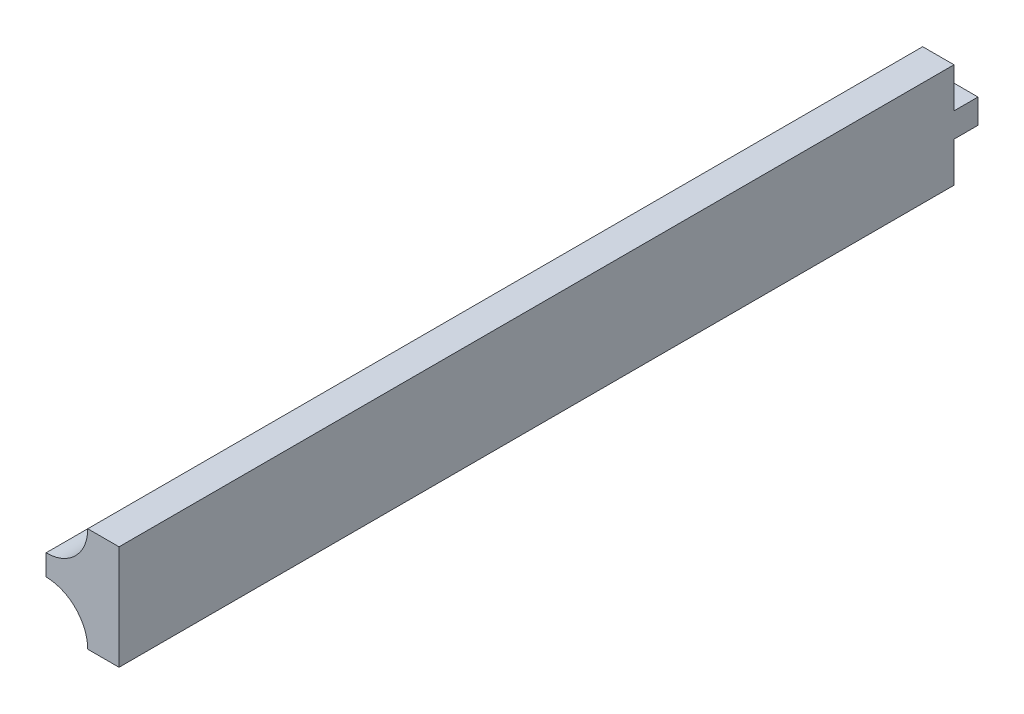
SolidWorks part; units mm, degrees
other "Markup1"
sketch "Sketch18" plane through (-127, 2.54, 10.16) normal (0, 1, 0) x (1, 0, 0)
sketch "Sketch20" plane through (-127, 2.54, 10.16) normal (0, 1, 0) x (1, 0, 0)
sketch "Sketch21" plane through (-127, 2.54, 10.16) normal (0, 1, 0) x (1, 0, 0)
sketch "Sketch22" plane through (-127, 2.54, 10.16) normal (0, 1, 0) x (1, 0, 0)
sketch "Sketch23" plane through (-127, 2.54, 10.16) normal (0, 1, 0) x (1, 0, 0)
sketch "Sketch24" plane through (-127, 2.54, 10.16) normal (0, 1, 0) x (1, 0, 0)
sketch "Sketch25" plane through (-127, 2.54, 10.16) normal (0, 1, 0) x (1, 0, 0)
sketch "Sketch27" plane through (-127, 2.54, 0) normal (0, 1, 0) x (1, 0, 0)
sketch "Sketch29" plane through (-127, 2.54, 0) normal (0, 1, 0) x (1, 0, 0)
sketch "Sketch30" plane through (-127, 2.54, 0) normal (0, 1, 0) x (1, 0, 0)
ref_plane "Front Plane" through (0, 0, 0) normal (0, 0, 1) x (1, 0, 0)
ref_plane "Top Plane" through (0, 0, 0) normal (0, 1, 0) x (1, 0, 0)
ref_plane "Right Plane" through (0, 0, 0) normal (1, 0, 0) x (0, 0, -1)
sketch "Sketch1" plane through (0, 0, 0) normal (0, 0, 1) x (1, 0, 0)
  line L6 (127, 2.54) -> (-127, 2.54)
  line L24 (127, 2.54) -> (127, -2.54)
  line L25 (127, -2.54) -> (-127, -2.54)
  line L26 (-127, 2.54) -> (-127, -2.54)
  line L27 (127, 2.54) -> (-127, -2.54) construction
  line L28 (127, -2.54) -> (-127, 2.54) construction
  point P0 (0, 0)
  point P1 (0, 0)
  dimension "D1" = 5.08
  dimension "D2" = 254
extrude "Boss-Extrude1" add sketch "Sketch1" along normal blind 203.2
sketch "Sketch2" plane through (0, 2.54, 0) normal (0, 1, 0) x (1, 0, 0)
  line L0 (127, -203.2) -> (-127, -203.2) construction
  line L1 (-127, 0) -> (-101.6, 0)
  line L2 (-127, 0) -> (-127, -203.2)
  line L3 (-127, -203.2) -> (-101.6, -203.2)
  line L4 (-101.6, 0) -> (-101.6, -203.2)
  line L6 (127, 0) -> (101.6, 0)
  line L7 (127, 0) -> (127, -203.2)
  line L8 (127, -203.2) -> (101.6, -203.2)
  line L9 (101.6, 0) -> (101.6, -203.2)
  dimension "D1" = 25.4
sketch "Sketch3" plane through (0, 2.54, 0) normal (0, 1, 0) x (1, 0, 0)
  line L1 (-127, -22.86) -> (-101.6, -22.86) construction
  line L2 (-127, 0) -> (-127, -203.2) construction
  line L3 (-101.6, 0) -> (-101.6, -203.2) construction
  line L4 (-114.3, -22.86) -> (-114.3, -180.34) construction
  line L5 (0, 0) -> (0, -203.2) construction
  line L6 (127, 0) -> (-127, 0) construction
  line L7 (127, -203.2) -> (-127, -203.2) construction
  line L8 (-127, 0) -> (-101.6, 0) construction
  line L9 (101.6, -21.6084) -> (127, -21.6084) construction
  line L10 (101.6, 0) -> (101.6, -203.2) construction
  line L11 (127, 0) -> (127, -203.2) construction
  circle A0 centre (-114.3, -22.86) radius 2.1
  circle A1 centre (-114.3, -180.34) radius 2.1
  circle A2 centre (114.3, -22.86) radius 2.1
  circle A3 centre (114.3, -180.34) radius 2.1
  point P14 (-114.3, -22.86)
  point P21 (-114.3, -101.6)
  point P22 (0, -101.6)
  point P26 (114.3, -21.6084)
  dimension "D1" = 4.2
  dimension "D2" = 22.86
extrude "Cut-Extrude1" [suppressed] cut sketch "Sketch3" against normal through all
sketch "Sketch5" plane through (0, 2.54, 0) normal (0, 1, 0) x (1, 0, 0)
  circle A2 centre (97.63, -133.2) radius 1.8288
  circle A3 centre (97.63, -133.2) radius 1.8288
  circle A4 centre (97.63, -145.9) radius 1.8288
  circle A5 centre (97.63, -145.9) radius 1.8288
  circle A6 centre (-19.21, -133.2) radius 1.8288
  circle A7 centre (-19.21, -133.2) radius 1.8288
  circle A8 centre (-19.21, -145.9) radius 1.8288
  circle A9 centre (-19.21, -145.9) radius 1.8288
  circle A13 centre (-97.696, -133.2) radius 1.8288
  circle A14 centre (-97.696, -145.9) radius 1.8288
  circle A15 centre (19.144, -133.2) radius 1.8288
  circle A16 centre (19.144, -145.9) radius 1.8288
  dimension "D5" = 78.486
  dimension "D6" = 78.486
  dimension "D1" = 0
  dimension "D2" = 0
  dimension "D3" = 0
  dimension "D4" = 0
extrude "Cut-Extrude2" cut sketch "Sketch5" against normal blind 152.4
sketch "Sketch7" [suppressed] plane through (0, -2.54, 0) normal (0, -1, 0) x (1, 0, 0)
  line L1 (-127, 203.2) -> (-101.6, 203.2)
  line L2 (-127, 203.2) -> (-127, 0)
  line L3 (-127, 0) -> (-101.6, 0)
  line L4 (-101.6, 203.2) -> (-101.6, 0)
  line L5 (127, 203.2) -> (101.6, 203.2)
  line L6 (127, 203.2) -> (127, 0)
  line L7 (127, 0) -> (101.6, 0)
  line L8 (101.6, 203.2) -> (101.6, 0)
  circle A0 centre (-114.3, 180.34) radius 6.35
  circle A1 centre (-114.3, 22.86) radius 6.35
  circle A2 centre (114.3, 22.86) radius 6.35
  circle A3 centre (114.3, 180.34) radius 6.35
  dimension "D1" = 12.7
extrude "Boss-Extrude2" [suppressed] add sketch "Sketch7" along normal blind 7.62
sketch "Sketch8" [suppressed] plane through (0, 2.54, 0) normal (0, 1, 0) x (1, 0, 0)
  circle A0 centre (-89.6874, -180.34) radius 3.175
  circle A1 centre (-89.6874, -154.94) radius 3.175
  point P3 (-114.3, -180.34)
  dimension "D1" = 6.35
  dimension "D2" = 24.6126
  dimension "D3" = 25.4
sketch "Sketch9" plane through (0, 2.54, 0) normal (0, 1, 0) x (1, 0, 0)
  line L0 (127, 0) -> (-127, 0) construction
  line L1 (-91.63, 0) -> (-83.63, 0)
  line L2 (-91.63, 0) -> (-91.63, -12.7)
  line L3 (-91.63, -12.7) -> (-83.63, -12.7)
  line L4 (-83.63, 0) -> (-83.63, -12.7)
  line L5 (-87.63, 0) -> (-87.63, -55.7623) construction
  line L6 (-127, -203.2) -> (-127, 0) construction
  line L7 (-61.405, -25.4) -> (-61.405, -12.7) construction
  circle A0 centre (-61.405, -12.7) radius 3.175
  circle A1 centre (-61.405, -25.4) radius 3.175
  dimension "D1" = 6.35
  dimension "D2" = 6.35
  dimension "D3" = 39.37
  dimension "D4" = 12.7
  dimension "D5" = 12.7
  dimension "D6" = 8
  dimension "D7" = 22.225
  dimension "D8" = 4
  dimension "D9" = 12.7
sketch "Sketch12" plane through (0, 2.54, 0) normal (0, 1, 0) x (1, 0, 0)
  line L0 (-91.7385, -29.21) -> (-40.9385, -29.21) construction
  line L1 (-127, -203.2) -> (-127, 0) construction
  line L2 (-66.3384, -41.91) -> (-66.3384, -16.51) construction
  line L4 (127, 0) -> (-127, 0) construction
  circle A0 centre (-91.7385, -29.21) radius 3.175
  circle A1 centre (-40.9385, -29.21) radius 3.175
  circle A2 centre (-66.3384, -16.51) radius 3.175
  circle A3 centre (-66.3384, -41.91) radius 3.175
  point P8 (-66.3385, -29.21)
  point P11 (-66.3385, -29.21)
  dimension "D1" = 6.35
  dimension "D2" = 50.8
  dimension "D3" = 29.21
  dimension "D4" = 25.4
  dimension "D5" = 60.6615
extrude "Cut-Extrude7" cut sketch "Sketch12" against normal through all
sketch "Sketch14" plane through (0, 2.54, 0) normal (0, 1, 0) x (1, 0, 0)
  line L0 (127, 0) -> (-127, 0) construction
  line L1 (-127, -203.2) -> (-127, 0) construction
  circle A0 centre (-32.8328, -16.51) radius 3.175
  circle A1 centre (-32.8328, -41.91) radius 3.175
  dimension "D1" = 6.35
  dimension "D4" = 94.1672
  dimension "D2" = 25.4
  dimension "D3" = 16.51
extrude "Cut-Extrude8" cut sketch "Sketch14" against normal up to next
mirror "Mirror1" about plane through (0, 0, 0) normal (1, 0, 0) of "Cut-Extrude8", "Cut-Extrude7"
sketch "Sketch15" plane through (0, 2.54, 0) normal (0, 1, 0) x (1, 0, 0)
  line L0 (127, -203.2) -> (127, 0) construction
  line L1 (-127, 0) -> (127, 0)
  line L2 (-127, 0) -> (-127, -10.16)
  line L3 (-127, -10.16) -> (127, -10.16)
  line L4 (127, 0) -> (127, -10.16)
  dimension "D1" = 10.16
extrude "Cut-Extrude9" [suppressed] cut sketch "Sketch15" against normal up to next
sketch "Sketch16" plane through (0, 2.54, 0) normal (0, 1, 0) x (1, 0, 0)
  line L0 (127, -203.2) -> (127, 0) construction
  line L1 (127, -203.2) -> (-127, -203.2) construction
  circle A0 centre (84.0486, -196.85) radius 3.175
  circle A1 centre (84.0486, -171.45) radius 3.175
  dimension "D2" = 6.35
  dimension "D1" = 42.9514
  dimension "D3" = 25.4
  dimension "D4" = 6.35
extrude "Cut-Extrude10" cut sketch "Sketch16" against normal through all
mirror "Mirror2" about plane through (0, 0, 0) normal (1, 0, 0) of "Cut-Extrude10"
sketch "Sketch17" plane through (0, 2.54, 0) normal (0, 1, 0) x (1, 0, 0)
  line L0 (-97.696, -133.2) -> (-19.21, -133.2) construction
  line L1 (-58.453, -133.2) -> (-58.453, -151.0054) construction
  point P6 (-19.21, -133.2)
ref_plane "Plane1" through (-58.453, 0, 0) normal (-1, 0, 0) x (0, 0, 1)
sketch "Sketch19" plane through (0, 2.54, 0) normal (0, 1, 0) x (1, 0, 0)
  line L0 (-84.0486, -171.45) -> (-28.3574, -171.45) construction
  line L1 (-84.0486, -196.85) -> (-28.3574, -196.85) construction
  line L2 (-84.0486, -182.2625) -> (-58.453, -182.2625) construction
  line L3 (-58.453, 111.76) -> (-58.453, -111.76) construction
  line L4 (-58.453, -182.2625) -> (-32.8574, -182.2625) construction
  circle A0 centre (-28.3574, -171.45) radius 3.175
  circle A1 centre (-28.3574, -196.85) radius 3.175
  circle A2 centre (-84.0486, -171.45) radius 3.175 construction
  dimension "D1" = 4.5
extrude "Cut-Extrude11" cut sketch "Sketch19" against normal up to next
mirror "Mirror3" about plane through (0, 0, 0) normal (1, 0, 0) of "Cut-Extrude11"
sketch "Sketch26" plane through (0, 2.54, 0) normal (0, 1, 0) x (1, 0, 0)
  line L1 (-98.2063, -23.913) -> (-35.7027, -23.913)
  line L2 (-98.2063, -23.913) -> (-98.2063, -34.7388)
  line L3 (-98.2063, -34.7388) -> (-35.7027, -34.7388)
  line L4 (-35.7027, -23.913) -> (-35.7027, -34.7388)
  line L5 (31.7031, -23.913) -> (98.7003, -23.913)
  line L6 (31.7031, -23.913) -> (31.7031, -34.7388)
  line L7 (31.7031, -34.7388) -> (98.7003, -34.7388)
  line L8 (98.7003, -23.913) -> (98.7003, -34.7388)
extrude "Boss-Extrude3" add sketch "Sketch26" against normal up to surface (5.08 mm away)
sketch "Sketch28" plane through (0, 2.54, 0) normal (0, 1, 0) x (1, 0, 0)
  line L0 (127, -203.2) -> (-127, -203.2) construction
  line L1 (-68.903, -203.2) -> (-43.503, -203.2)
  line L2 (-68.903, -203.2) -> (-68.903, -190.5)
  line L3 (-68.903, -190.5) -> (-43.503, -190.5)
  line L4 (-43.503, -203.2) -> (-43.503, -190.5)
  line L5 (-84.0486, -171.45) -> (-28.3574, -171.45) construction
  line L6 (43.503, -203.2) -> (68.903, -203.2)
  line L7 (43.503, -203.2) -> (43.503, -190.5)
  line L8 (43.503, -190.5) -> (68.903, -190.5)
  line L9 (68.903, -203.2) -> (68.903, -190.5)
  line L10 (28.3574, -171.45) -> (84.0486, -171.45) construction
  point P18 (-56.203, -190.5)
  point P19 (-56.203, -171.45)
  point P20 (56.203, -190.5)
  point P21 (56.203, -171.45)
  dimension "D1" = 25.4
  dimension "D2" = 12.7
extrude "Cut-Extrude12" cut sketch "Sketch28" against normal up to next
sketch "Sketch31" plane through (0, 2.54, 0) normal (0, 1, 0) x (1, 0, 0)
  line L0 (-127, 0) -> (127, 0) construction
  line L2 (-127, -203.2) -> (0, -203.2)
  line L3 (-127, -203.2) -> (-127, 0)
  line L4 (-127, 0) -> (0, 0)
  line L5 (0, -203.2) -> (0, 0)
extrude "Cut-Extrude14" cut sketch "Sketch31" against normal up to next
sketch "Sketch34" plane through (0, 2.54, 0) normal (0, 1, 0) x (1, 0, 0)
  line L1 (127, 0) -> (114.3, 0)
  line L2 (127, 0) -> (127, 152.4)
  line L3 (127, 152.4) -> (114.3, 152.4)
  line L4 (114.3, 0) -> (114.3, 152.4)
  dimension "D1" = 12.7
  dimension "D2" = 152.4
extrude "Boss-Extrude5" add sketch "Sketch34" against normal up to surface (5.08 mm away)
sketch "Sketch35" plane through (0, -2.54, 0) normal (0, -1, 0) x (1, 0, 0)
  line L0 (93.7489, 203.2) -> (93.7489, -151.0184)
  line L1 (68.903, 203.2) -> (127, 203.2) construction
  line L2 (127, 203.2) -> (127, -152.4) construction
  line L3 (127, -38.1) -> (93.7489, -38.1)
  line L4 (0, 0) -> (114.3, 0) construction
  point P10 (0, 0)
  dimension "D1" = 33.2511
  dimension "D2" = 38.1
sketch "Sketch36" plane through (114.3, 0, 0) normal (-1, 0, 0) x (0, 0, 1)
  line L0 (-38.1, -2.54) -> (-38.1, 2.54) construction
  line L1 (203.2, -2.54) -> (-151.0184, -2.54) construction
  line L2 (-152.4, 2.54) -> (0, 2.54) construction
  line L4 (-12.7, -25.4) -> (-63.5, -25.4)
  line L5 (-12.7, -25.4) -> (-12.7, 25.4)
  line L6 (-12.7, 25.4) -> (-63.5, 25.4)
  line L7 (-63.5, -25.4) -> (-63.5, 25.4)
  line L8 (-12.7, -25.4) -> (-63.5, 25.4) construction
  line L9 (-12.7, 25.4) -> (-63.5, -25.4) construction
  point P8 (-38.1, 0)
  dimension "D1" = 50.8
extrude "Boss-Extrude6" add sketch "Sketch36" against normal up to surface (12.7 mm away)
sketch "Sketch37" plane through (114.3, 0, 0) normal (-1, 0, 0) x (0, 0, 1)
  line L0 (-12.7, 25.4) -> (-63.5, 25.4) construction
  circle A0 centre (-38.1, 0) radius 4
  point P4 (-38.1, 25.4)
  point P5 (0, 0)
  point P7 (0, 0)
  dimension "D1" = 8
extrude "Cut-Extrude15" cut sketch "Sketch37" against normal up to next
sketch "Sketch38" plane through (0, -2.54, 0) normal (0, -1, 0) x (1, 0, 0)
  line L0 (127, -63.5) -> (114.3, -63.5) construction
  line L1 (102.4579, -63.5) -> (162.4454, -63.5)
  line L2 (102.4579, -63.5) -> (102.4579, -165.9179)
  line L3 (102.4579, -165.9179) -> (162.4454, -165.9179)
  line L4 (162.4454, -63.5) -> (162.4454, -165.9179)
extrude "Cut-Extrude16" cut sketch "Sketch38" against normal up to next
sketch "Sketch39" plane through (114.3, 0, 0) normal (-1, 0, 0) x (0, 0, 1)
  line L1 (-12.7, -25.4) -> (-63.5, -25.4)
  line L2 (-12.7, -25.4) -> (-12.7, 25.4)
  line L3 (-12.7, 25.4) -> (-63.5, 25.4)
  line L4 (-63.5, -25.4) -> (-63.5, 25.4)
  line L5 (-12.7, -25.4) -> (-63.5, 25.4) construction
  line L6 (-12.7, 25.4) -> (-63.5, -25.4) construction
  circle A0 centre (-38.1, 0) radius 4 construction
  circle A1 centre (-38.1, 0) radius 4
  point P0 (-38.1, 0)
extrude "Boss-Extrude7" add sketch "Sketch39" along normal up to vertex
sketch "Sketch40" plane through (93.7489, 0, 0) normal (-1, 0, 0) x (0, 0, 1)
  line L1 (-12.7, -25.4) -> (-63.5, -25.4)
  line L2 (-12.7, -25.4) -> (-12.7, 25.4)
  line L3 (-12.7, 25.4) -> (-63.5, 25.4)
  line L4 (-63.5, -25.4) -> (-63.5, 25.4)
  line L5 (-12.7, -25.4) -> (-63.5, 25.4) construction
  line L6 (-12.7, 25.4) -> (-63.5, -25.4) construction
  circle A0 centre (-38.1, 0) radius 8.255
  circle A1 centre (-38.1, 0) radius 4 construction
  dimension "D1" = 16.51
extrude "Cut-Extrude17" cut sketch "Sketch40" against normal blind 2.54
sketch "Sketch41" plane through (0, 0, 0) normal (0, 0, -1) x (-1, 0, 0)
  line L0 (-127, -2.54) -> (-93.7489, -2.54) construction
  line L1 (-114.3, -2.54) -> (-96.2889, -2.54)
  line L2 (-114.3, -2.54) -> (-114.3, 2.54)
  line L3 (-114.3, 2.54) -> (-96.2889, 2.54)
  line L4 (-96.2889, -2.54) -> (-96.2889, 2.54)
  line L5 (-114.3, 2.54) -> (0, 2.54) construction
  line L6 (-96.2889, -25.4) -> (-96.2889, 25.4) construction
  line L7 (-114.3, -2.54) -> (-114.3, 2.54) construction
  point P10 (-106.9257, 2.54)
extrude "Boss-Extrude8" add sketch "Sketch41" along normal up to surface (12.7 mm away)
sketch "Sketch42" plane through (0, 0, -12.7) normal (0, 0, 1) x (1, 0, 0)
  line L6 (79.901, 2.54) -> (79.901, -2.54) construction
  line L7 (127, 2.54) -> (68.903, 2.54) construction
  line L8 (68.903, -2.54) -> (127, -2.54) construction
  line L9 (127, 25.4) -> (127, 2.54) construction
  line L10 (127, 12.7) -> (119.38, 12.7)
  line L11 (127, 12.7) -> (127, 2.54)
  line L12 (127, 2.54) -> (119.38, 2.54)
  line L13 (119.38, 12.7) -> (119.38, 2.54)
  line L15 (127, 2.54) -> (96.2889, 2.54) construction
  point P14 (0, 0)
  point P15 (79.901, 0)
  point P16 (111.6444, 11.298)
  dimension "D1" = 10.16
  dimension "D2" = 7.62
extrude "Boss-Extrude9" add sketch "Sketch42" along normal up to surface (215.9 mm away)
ref_plane "Plane2" through (0, 0, 0) normal (0, -1, 0) x (-1, 0, 0)
mirror "Mirror4" about plane through (0, 0, 0) normal (0, -1, 0) of "Boss-Extrude9"
fillet "Fillet2" radius 12.7 1 edges at (96.2889, 0, 0)
fillet "Fillet3" radius 10.16 4 edges at (119.38, 2.54, 95.25) (119.38, -2.54, 95.25) (119.38, 7.62, -12.7) (119.38, -7.62, -12.7)
fillet "Fillet4" radius 6.35 12 edges at (96.2889, -25.4, -38.1) (96.2889, 0, -63.5) (96.2889, 25.4, -38.1) (96.2889, 13.97, -12.7) (96.2889, -13.97, -12.7) (96.2889, 0, -29.845) (0, 0, 203.2) (0, 0, 0) (111.6444, 25.4, -12.7) (111.6444, 25.4, -63.5) (111.6444, -25.4, -63.5) (111.6444, -25.4, -12.7)
fillet "Fillet5" radius 5.08 2 edges at (68.903, 0, 190.5) (43.503, 0, 190.5)
sketch "Sketch43" plane through (127, 0, 0) normal (1, 0, 0) x (0, 0, -1)
  circle A0 centre (38.1, 0) radius 9.525
  circle A1 centre (38.1, 0) radius 4 construction
  dimension "D1" = 19.05
extrude "Cut-Extrude18" cut sketch "Sketch43" against normal blind 10.16
sketch "Sketch44" plane through (0, 2.54, 0) normal (0, 1, 0) x (1, 0, 0)
  line L0 (83.5889, 0) -> (6.35, 0) construction
  line L1 (-62.3754, 89.2362) -> (191.0738, 89.2362)
  line L2 (-62.3754, 89.2362) -> (-62.3754, 0)
  line L3 (-62.3754, 0) -> (191.0738, 0)
  line L4 (191.0738, 89.2362) -> (191.0738, 0)
  point P4 (191.0738, 4.903)
extrude "Cut-Extrude19" cut sketch "Sketch44" against normal through all both and the other way through all
sketch "Sketch45" plane through (0, 0, 0) normal (0, 0, -1) x (-1, 0, 0)
  line L1 (-127, 2.9845) -> (-121.031, 2.9845)
  line L2 (-127, 2.9845) -> (-127, -2.9845)
  line L3 (-127, -2.9845) -> (-121.031, -2.9845)
  line L4 (-121.031, 2.9845) -> (-121.031, -2.9845)
  line L5 (-127, 2.9845) -> (-121.031, -2.9845) construction
  line L6 (-127, -2.9845) -> (-121.031, 2.9845) construction
  line L7 (-127, -12.7) -> (-127, 12.7) construction
  point P0 (-124.0155, 0)
  point P7 (0, 0)
  point P8 (-124.2497, 7.0375)
  point P9 (-127, 0)
  dimension "D1" = 5.969
extrude "Boss-Extrude10" add sketch "Sketch45" along normal blind 5.842
sketch "Sketch46" plane through (0, 2.54, 0) normal (0, 1, 0) x (1, 0, 0)
  line L0 (109.22, -203.2) -> (109.22, 0) construction
  line L1 (-15.9681, 55.8325) -> (109.22, 55.8325)
  line L2 (-15.9681, 55.8325) -> (-15.9681, -229.8283)
  line L3 (-15.9681, -229.8283) -> (109.22, -229.8283)
  line L4 (109.22, 55.8325) -> (109.22, -229.8283)
extrude "Cut-Extrude20" cut sketch "Sketch46" against normal through all
sketch "Sketch47" plane through (109.22, 0, 0) normal (-1, 0, 0) x (0, 0, 1)
  line L1 (5.842, -1.397) -> (197.358, -1.397)
  line L2 (5.842, -1.397) -> (5.842, 1.397)
  line L3 (5.842, 1.397) -> (197.358, 1.397)
  line L4 (197.358, -1.397) -> (197.358, 1.397)
  line L5 (5.842, -1.397) -> (197.358, 1.397) construction
  line L6 (5.842, 1.397) -> (197.358, -1.397) construction
  line L7 (49.8378, 2.54) -> (49.8378, -2.54) construction
  line L8 (203.2, 2.54) -> (0, 2.54) construction
  line L9 (203.2, -2.54) -> (-151.0184, -2.54) construction
  line L10 (0, 2.54) -> (0, -2.54) construction
  line L11 (203.2, 2.54) -> (203.2, -2.54) construction
  point P0 (101.6, 0)
  point P11 (49.8378, 0)
  dimension "D1" = 2.794
  dimension "D2" = 5.842
  dimension "D3" = 5.842
extrude "Cut-Extrude21" cut sketch "Sketch47" against normal blind 5.588
sketch "Sketch32" plane through (0, 2.54, 0) normal (0, 1, 0) x (1, 0, 0)
  line L1 (0, 0) -> (6.35, 0)
  line L2 (0, 0) -> (0, -25.4)
  line L3 (0, -25.4) -> (6.35, -25.4)
  line L4 (6.35, 0) -> (6.35, -25.4)
  dimension "D1" = 25.4
  dimension "D2" = 6.35
extrude "Boss-Extrude4" add sketch "Sketch32" along normal blind 25.4
